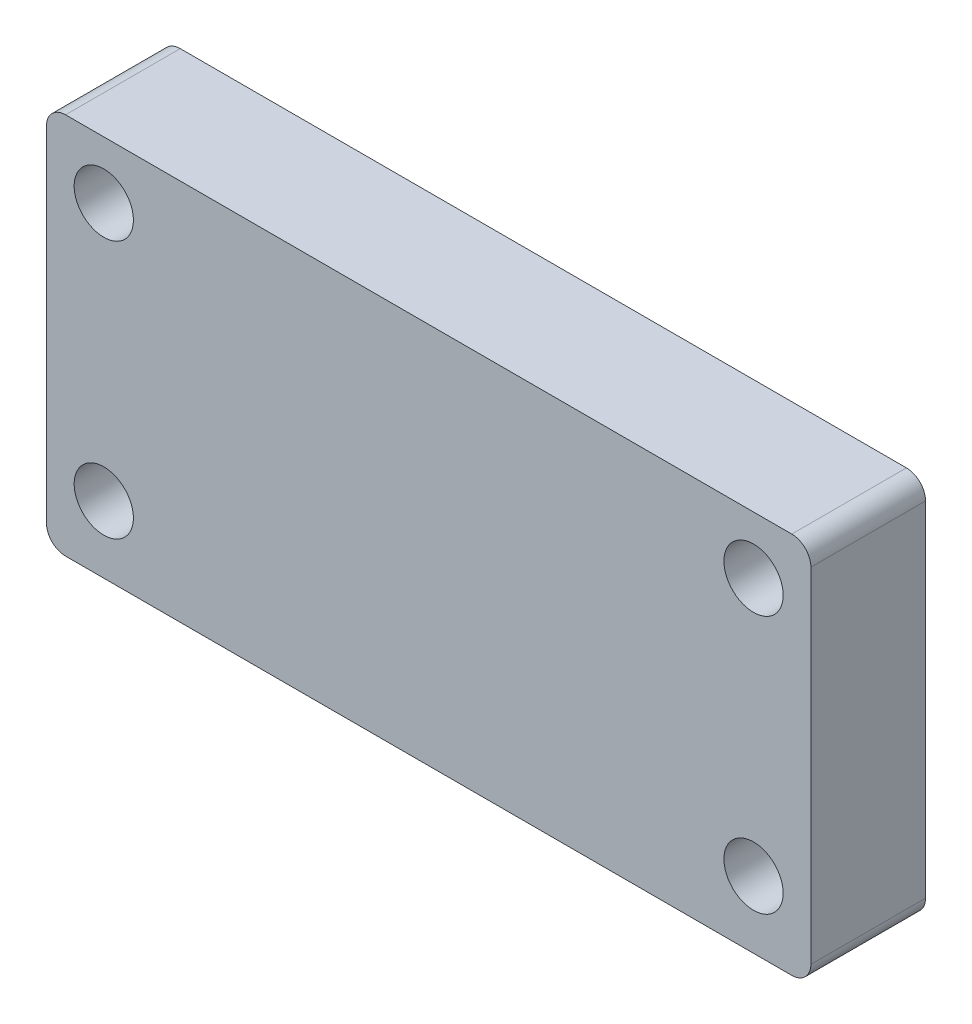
SolidWorks part; units mm, degrees
ref_plane "Plan de face" through (0, 0, 0) normal (0, 0, 1) x (1, 0, 0)
ref_plane "Plan de dessus" through (0, 0, 0) normal (0, 1, 0) x (1, 0, 0)
ref_plane "Plan de droite" through (0, 0, 0) normal (1, 0, 0) x (0, 0, -1)
sketch "Esquisse1" plane through (0, 0, 0) normal (0, 0, 1) x (1, 0, 0)
  line L1 (0, 0) -> (40, 0)
  line L2 (0, 0) -> (0, 20)
  line L3 (0, 20) -> (40, 20)
  line L4 (40, 0) -> (40, 20)
  circle A0 centre (3, 17) radius 1.55
  circle A1 centre (37, 17) radius 1.55
  circle A2 centre (37, 3.5) radius 1.55
  circle A3 centre (3, 3.5) radius 1.55
  point P13 (0, 0)
  point P14 (0, 0)
  point P15 (0, 0)
  point P16 (0, 0)
  point P17 (2.5562, 2.0916)
  dimension "D3" = 3.5
  dimension "D4" = 3.1
  dimension "D1" = 20
  dimension "D2" = 40
  dimension "D5" = 3
  dimension "D6" = 3
  dimension "D7" = 3
extrude "Boss.-Extru.1" add sketch "Esquisse1" along normal blind 6
sketch "Esquisse2" plane through (0, 0, 0) normal (-1, 0, 0) x (0, 0, 1)
  line L0 (6, 20) -> (6, 0) construction
  line L1 (6, 20) -> (0, 20) construction
  circle A0 centre (-5, 12) radius 7.5
  dimension "D1" = 15
  dimension "D2" = 11
  dimension "D3" = 8
extrude "Enlèv. mat.-Extru.1" cut sketch "Esquisse2" against normal blind 25 from offset 5.5
fillet "Congé1" radius 1 4 edges at (40, 0, 3) (40, 20, 3) (0, 20, 3) (0, 0, 3)
